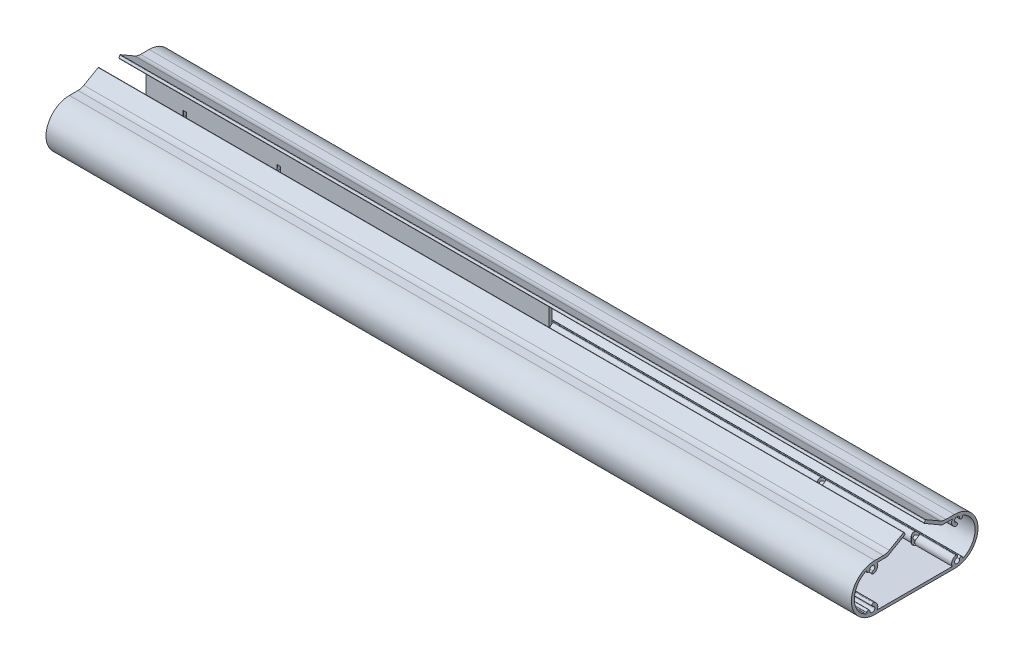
SolidWorks part; units mm, degrees
ref_plane "Plan de face" through (0, 0, 0) normal (0, 0, 1) x (1, 0, 0)
ref_plane "Plan de dessus" through (0, 0, 0) normal (0, 1, 0) x (1, 0, 0)
ref_plane "Plan de droite" through (0, 0, 0) normal (1, 0, 0) x (0, 0, -1)
ref_plane "Plan1" through (-343.5, 0, 0) normal (-1, 0, 0) x (0, -1, 0)
sketch "Esquisse1" plane through (-343.5, 0, 0) normal (-1, 0, 0) x (0, -1, 0)
  line L0 (-26.3509, 8) -> (-17.5, 23.3301)
  line L1 (-17.5, 23.3301) -> (-17.5, -23.3301)
  line L2 (-17.5, -23.3301) -> (-26.3509, -8)
  line L3 (-26.3509, -8) -> (-54.0637, -24)
  line L4 (-54.0637, -24) -> (-20, -24)
  line L5 (-20, -24) -> (-20, -34)
  line L6 (20, -34) -> (20, 34)
  line L7 (-20, 34) -> (-20, 24)
  line L8 (-20, 24) -> (-54.0637, 24)
  line L9 (-54.0637, 24) -> (-26.3509, 8)
  line L10 (10.3202, 34) -> (-10.3202, 34)
  line L11 (-10.3202, -34) -> (10.3202, -34)
  arc A0 (-20, -34) -> (20, -34) centre (0, -34) ccw
  arc A1 (20, 34) -> (-20, 34) centre (0, 34) ccw
  arc A2 (15.3389, 40.7979) -> (10.7938, 34.6602) centre (15.1987, 36.15) ccw
  arc A3 (10.7938, 34.6602) -> (10.3202, 34) centre (10.3202, 34.5) cw
  arc A4 (-10.3202, 34) -> (-10.7938, 34.6602) centre (-10.3202, 34.5) cw
  arc A5 (-10.7938, 34.6602) -> (-15.3389, 40.7979) centre (-15.1987, 36.15) ccw
  arc A6 (-15.3389, 40.7979) -> (-15.8056, 41.5123) centre (-15.354, 41.2977) cw
  arc A7 (-15.8056, 41.5123) -> (15.8056, 41.5123) centre (0, 34) cw
  arc A8 (15.8056, 41.5123) -> (15.3389, 40.7979) centre (15.354, 41.2977) cw
  arc A9 (10.7938, -34.6602) -> (15.3389, -40.7979) centre (15.1987, -36.15) ccw
  arc A10 (15.3389, -40.7979) -> (15.8056, -41.5123) centre (15.354, -41.2977) cw
  arc A11 (15.8056, -41.5123) -> (-15.8056, -41.5123) centre (0, -34) cw
  arc A12 (-15.8056, -41.5123) -> (-15.3389, -40.7979) centre (-15.354, -41.2977) cw
  arc A13 (-15.3389, -40.7979) -> (-10.7938, -34.6602) centre (-15.1987, -36.15) ccw
  arc A14 (-10.7938, -34.6602) -> (-10.3202, -34) centre (-10.3202, -34.5) cw
  arc A15 (10.3202, -34) -> (10.7938, -34.6602) centre (10.3202, -34.5) cw
extrude "Boss.-Extru.1" add sketch "Esquisse1" against normal blind 343.5
sketch "Esquisse2" plane through (0, 17.5, 0) normal (0, 1, 0) x (-1, 0, 0)
  line L0 (343.5, 23.3301) -> (0, 23.3301)
  line L1 (0, 23.3301) -> (0, -23.3301)
  line L2 (0, -23.3301) -> (343.5, -23.3301)
  line L3 (343.5, -23.3301) -> (343.5, 23.3301)
extrude "Enlèv. mat.-Extru.1" cut sketch "Esquisse2" against normal blind 35
sketch "Esquisse3" plane through (0, 0, 23.3301) normal (0, 0, -1) x (-1, 0, 0)
  line L0 (0, -17.5) -> (343.5, -17.5)
  line L1 (343.5, -17.5) -> (343.5, 17.5)
  line L2 (343.5, 17.5) -> (0, 17.5)
  line L3 (0, 17.5) -> (0, -17.5)
extrude "Enlèv. mat.-Extru.2" cut sketch "Esquisse3" against normal blind 8.1699
sketch "Esquisse4" plane through (0, 0, -23.3301) normal (0, 0, 1) x (1, 0, 0)
  line L0 (-343.5, -17.5) -> (0, -17.5)
  line L1 (0, -17.5) -> (0, 17.5)
  line L2 (0, 17.5) -> (-343.5, 17.5)
  line L3 (-343.5, 17.5) -> (-343.5, -17.5)
extrude "Enlèv. mat.-Extru.3" cut sketch "Esquisse4" against normal blind 8.1699
sketch "Esquisse5" plane through (0, 0, 0) normal (1, 0, 0) x (0, 0, -1)
  line L0 (-32.1094, -17.5) -> (32.1094, -17.5)
  line L1 (32.1094, 17.5) -> (23.3301, 17.5)
  line L2 (23.3301, 17.5) -> (8, 26.3509)
  line L3 (8, 26.3509) -> (24, 54.0637)
  line L4 (24, 54.0637) -> (24, 20)
  line L5 (24, 20) -> (34, 20)
  line L6 (34, -20) -> (-34, -20)
  line L7 (-34, 20) -> (-24, 20)
  line L8 (-24, 20) -> (-24, 54.0637)
  line L9 (-24, 54.0637) -> (-8, 26.3509)
  line L10 (-8, 26.3509) -> (-23.3301, 17.5)
  line L11 (-23.3301, 17.5) -> (-32.1094, 17.5)
  arc A0 (-40.7979, -15.3389) -> (-32.1094, -17.5) centre (-36.15, -15.1987) cw
  arc A1 (32.1094, -17.5) -> (40.7979, -15.3389) centre (36.15, -15.1987) cw
  arc A2 (40.7979, -15.3389) -> (41.5123, -15.8056) centre (41.2977, -15.354) ccw
  arc A3 (41.5123, -15.8056) -> (41.5123, 15.8056) centre (34, 0) ccw
  arc A4 (41.5123, 15.8056) -> (40.7979, 15.3389) centre (41.2977, 15.354) ccw
  arc A5 (40.7979, 15.3389) -> (32.1094, 17.5) centre (36.15, 15.1987) cw
  arc A6 (34, 20) -> (34, -20) centre (34, 0) cw
  arc A7 (-34, -20) -> (-34, 20) centre (-34, 0) cw
  arc A8 (-32.1094, 17.5) -> (-40.7979, 15.3389) centre (-36.15, 15.1987) cw
  arc A9 (-40.7979, 15.3389) -> (-41.5123, 15.8056) centre (-41.2977, 15.354) ccw
  arc A10 (-41.5123, 15.8056) -> (-41.5123, -15.8056) centre (-34, 0) ccw
  arc A11 (-41.5123, -15.8056) -> (-40.7979, -15.3389) centre (-41.2977, -15.354) ccw
extrude "Boss.-Extru.2" add sketch "Esquisse5" along normal blind 343.5
sketch "Esquisse6" plane through (343.5, 0, 0) normal (1, 0, 0) x (0, 0, -1)
  arc A0 (-34.9802, -10.6982) -> (-40.7986, -15.0827) centre (-36.15, -15.1987) ccw
  arc A1 (-40.7986, -15.0827) -> (-38.2993, -15.1451) centre (-39.5489, -15.1139) cw
  arc A2 (-38.2993, -15.1451) -> (-35.6091, -13.1178) centre (-36.15, -15.1987) cw
  arc A3 (-35.6091, -13.1178) -> (-34.9802, -10.6982) centre (-35.2947, -11.908) cw
extrude "Enlèv. mat.-Extru.4" cut sketch "Esquisse6" against normal through all
sketch "Esquisse7" plane through (343.5, 0, 0) normal (1, 0, 0) x (0, 0, -1)
  arc A0 (34.9802, -10.6982) -> (35.6091, -13.1178) centre (35.2947, -11.908) cw
  arc A1 (35.6091, -13.1178) -> (38.2993, -15.1451) centre (36.15, -15.1987) cw
  arc A2 (38.2993, -15.1451) -> (40.7986, -15.0827) centre (39.5489, -15.1139) cw
  arc A3 (40.7986, -15.0827) -> (34.9802, -10.6982) centre (36.15, -15.1987) ccw
extrude "Enlèv. mat.-Extru.5" cut sketch "Esquisse7" against normal through all
sketch "Esquisse8" plane through (343.5, 0, 0) normal (1, 0, 0) x (0, 0, -1)
  arc A0 (34.9802, 10.6982) -> (40.7986, 15.0827) centre (36.15, 15.1987) ccw
  arc A1 (40.7986, 15.0827) -> (38.2993, 15.1451) centre (39.5489, 15.1139) cw
  arc A2 (38.2993, 15.1451) -> (35.6091, 13.1178) centre (36.15, 15.1987) cw
  arc A3 (35.6091, 13.1178) -> (34.9802, 10.6982) centre (35.2947, 11.908) cw
extrude "Enlèv. mat.-Extru.6" cut sketch "Esquisse8" against normal through all
sketch "Esquisse9" plane through (343.5, 0, 0) normal (1, 0, 0) x (0, 0, -1)
  arc A0 (-34.9802, 10.6982) -> (-35.6091, 13.1178) centre (-35.2947, 11.908) cw
  arc A1 (-35.6091, 13.1178) -> (-38.2993, 15.1451) centre (-36.15, 15.1987) cw
  arc A2 (-38.2993, 15.1451) -> (-40.7986, 15.0827) centre (-39.5489, 15.1139) cw
  arc A3 (-40.7986, 15.0827) -> (-34.9802, 10.6982) centre (-36.15, 15.1987) ccw
extrude "Enlèv. mat.-Extru.7" cut sketch "Esquisse9" against normal through all
sketch "Esquisse10" plane through (0, 17.5, 0) normal (0, -1, 0) x (1, 0, 0)
  line L0 (0, -25) -> (0, -29)
  line L1 (0, -29) -> (-343.5, -29)
  line L2 (-343.5, -29) -> (-343.5, -25)
  line L3 (-343.5, -25) -> (0, -25)
extrude "Boss.-Extru.3" add sketch "Esquisse10" along normal blind 1
sketch "Esquisse11" plane through (0, -17.5, 0) normal (0, 1, 0) x (-1, 0, 0)
  line L0 (343.5, -25) -> (343.5, -29)
  line L1 (343.5, -29) -> (0, -29)
  line L2 (0, -29) -> (0, -25)
  line L3 (0, -25) -> (343.5, -25)
extrude "Boss.-Extru.4" add sketch "Esquisse11" along normal blind 1
sketch "Esquisse12" plane through (0, -17.5, 0) normal (0, 1, 0) x (-1, 0, 0)
  line L0 (0, 25) -> (0, 29)
  line L1 (0, 29) -> (343.5, 29)
  line L2 (343.5, 29) -> (343.5, 25)
  line L3 (343.5, 25) -> (0, 25)
extrude "Boss.-Extru.5" add sketch "Esquisse12" along normal blind 1
sketch "Esquisse13" plane through (0, 17.5, 0) normal (0, -1, 0) x (1, 0, 0)
  line L0 (-343.5, 25) -> (-343.5, 29)
  line L1 (-343.5, 29) -> (0, 29)
  line L2 (0, 29) -> (0, 25)
  line L3 (0, 25) -> (-343.5, 25)
extrude "Boss.-Extru.6" add sketch "Esquisse13" along normal blind 1
draft "Dépouille1" type of draft neutral plane draft angle 60 faces to draft 1 parameters "D1"=60
draft "Dépouille2" type of draft neutral plane draft angle 60 faces to draft 1 parameters "D1"=60
ref_plane "Plan2" through (0, 0, -36.15) normal (0, 0, 1) x (1, 0, 0)
sketch "Esquisse14" plane through (0, 0, -36.15) normal (0, 0, 1) x (1, 0, 0)
  line L0 (-343.5, -13.0487) -> (-343.5, -15.1987)
  line L1 (-343.5, -15.1987) -> (343.5, -15.1987)
  line L2 (343.5, -15.1987) -> (343.5, -13.0487)
  line L3 (343.5, -13.0487) -> (-343.5, -13.0487)
  line L4 (-343.5, -15.1987) -> (343.5, -15.1987) construction
revolve "Enlèvement de matière-Révolution1" cut sketch "Esquisse14" angle 360 about L4
sketch "Esquisse15" plane through (0, 0, -36.15) normal (0, 0, 1) x (1, 0, 0)
  line L0 (-343.5, 17.3487) -> (-343.5, 15.1987)
  line L1 (-343.5, 15.1987) -> (343.5, 15.1987)
  line L2 (343.5, 15.1987) -> (343.5, 17.3487)
  line L3 (343.5, 17.3487) -> (-343.5, 17.3487)
  line L4 (-343.5, 15.1987) -> (343.5, 15.1987) construction
revolve "Enlèvement de matière-Révolution2" cut sketch "Esquisse15" angle 360 about L4
ref_plane "Plan3" through (0, 0, 36.15) normal (0, 0, 1) x (1, 0, 0)
sketch "Esquisse16" plane through (0, 0, 36.15) normal (0, 0, 1) x (1, 0, 0)
  line L0 (-343.5, -13.0487) -> (-343.5, -15.1987)
  line L1 (-343.5, -15.1987) -> (343.5, -15.1987)
  line L2 (343.5, -15.1987) -> (343.5, -13.0487)
  line L3 (343.5, -13.0487) -> (-343.5, -13.0487)
  line L4 (-343.5, -15.1987) -> (343.5, -15.1987) construction
revolve "Enlèvement de matière-Révolution3" cut sketch "Esquisse16" angle 360 about L4
sketch "Esquisse17" plane through (0, 0, 36.15) normal (0, 0, 1) x (1, 0, 0)
  line L0 (-343.5, 17.3487) -> (-343.5, 15.1987)
  line L1 (-343.5, 15.1987) -> (343.5, 15.1987)
  line L2 (343.5, 15.1987) -> (343.5, 17.3487)
  line L3 (343.5, 17.3487) -> (-343.5, 17.3487)
  line L4 (-343.5, 15.1987) -> (343.5, 15.1987) construction
revolve "Enlèvement de matière-Révolution4" cut sketch "Esquisse17" angle 360 about L4
hole_wizard "Diamètre du perçage Ø5.0 (5)1" positions "Esquisse19" profile "Esquisse18" hole size "Ø5.0" standard "Ansi Metric"
sketch "Esquisse19" plane through (0, -20, 0) normal (0, -1, 0) x (-1, 0, 0)
  line L1 (-230.5, -33.5) -> (-310.5, -33.5) construction
  line L2 (-230.5, -33.5) -> (-230.5, 33.5) construction
  line L3 (-230.5, 33.5) -> (-310.5, 33.5) construction
  line L4 (-310.5, -33.5) -> (-310.5, 33.5) construction
  line L7 (310.5, -33.5) -> (230.5, -33.5) construction
  line L8 (310.5, -33.5) -> (310.5, 33.5) construction
  line L9 (310.5, 33.5) -> (230.5, 33.5) construction
  line L10 (230.5, -33.5) -> (230.5, 33.5) construction
  line L12 (343.5, 34) -> (343.5, -34) construction
  line L13 (-343.5, -34) -> (-343.5, 34) construction
  point P0 (-310.5, -33.5)
  point P1 (-230.5, -33.5)
  point P2 (230.5, -33.5)
  point P3 (310.5, -33.5)
  point P4 (310.5, 33.5)
  point P5 (230.5, 33.5)
  point P6 (-230.5, 33.5)
  point P7 (-310.5, 33.5)
  dimension "D1" = 80
  dimension "D2" = 80
  dimension "D3" = 33
  dimension "D4" = 67
  dimension "D5" = 67
  dimension "D6" = 33
sketch "Esquisse18" plane through (310.5, -20, 33.5) normal (1, 0, 0) x (0, 0, -1)
  line L0 (0, 0) -> (0, 12)
  line L1 (0, 12) -> (2.5, 12)
  line L2 (2.5, 12) -> (2.5, 0)
  line L5 (2.5, 0) -> (0, 0)
  line L10 (0, 12) -> (-2.5, 12) construction
  line L11 (0, -6.35) -> (0, 107.95) construction
  dimension "Diamètre du perçage" = 5
  dimension "Profondeur du perçage" = 12
  dimension "Angle de pointe" = 180
fillet "Congé1" radius 0.3 12 edges at (-171.75, 16.5, 29) (-171.75, -16.5, -25) (0, 26.3509, 8) (0, 26.3509, -8) (-171.75, -16.5, -29) (-171.75, 16.5, -29) (-171.75, 16.5, 25) (-171.75, 16.5, -25) (0, 28.5159, 9.25) (-171.75, -16.5, 29) (0, 28.5159, -9.25) (-171.75, -16.5, 25)
fillet "Congé2" radius 0.5 16 edges at (-270.5, -17.5, -31.5) (-114.5, -17.5, -31.5) (-171.75, 17.5, -25) (-270.5, -17.5, 31.5) (-171.75, 17.5, -29) (-171.75, -17.5, -29) (-171.75, -17.5, -25) (-114.5, -17.5, 31.5) (-171.75, -17.5, 25) (-171.75, -17.5, 29) (-327.75, -17.5, 31.5) (-171.75, 17.5, 25) (-327.75, -17.5, -31.5) (-171.75, 17.5, 29) (-171.75, 17.5, -31.5) (-171.75, 17.5, 31.5)
fillet "Congé3" radius 2 1 edges at (0, 17.5, -23.3301)
fillet "Congé4" radius 10 2 edges at (0, 20, -24) (0, 20, 24)
sketch "Esquisse20" plane through (0, 0, -34) normal (0, 0, -1) x (-1, 0, 0)
  circle A0 centre (-245.5, 0) radius 10
  circle A1 centre (269.5, 0) radius 10
extrude "Enlèv. mat.-Extru.8" cut sketch "Esquisse20" along normal through all
